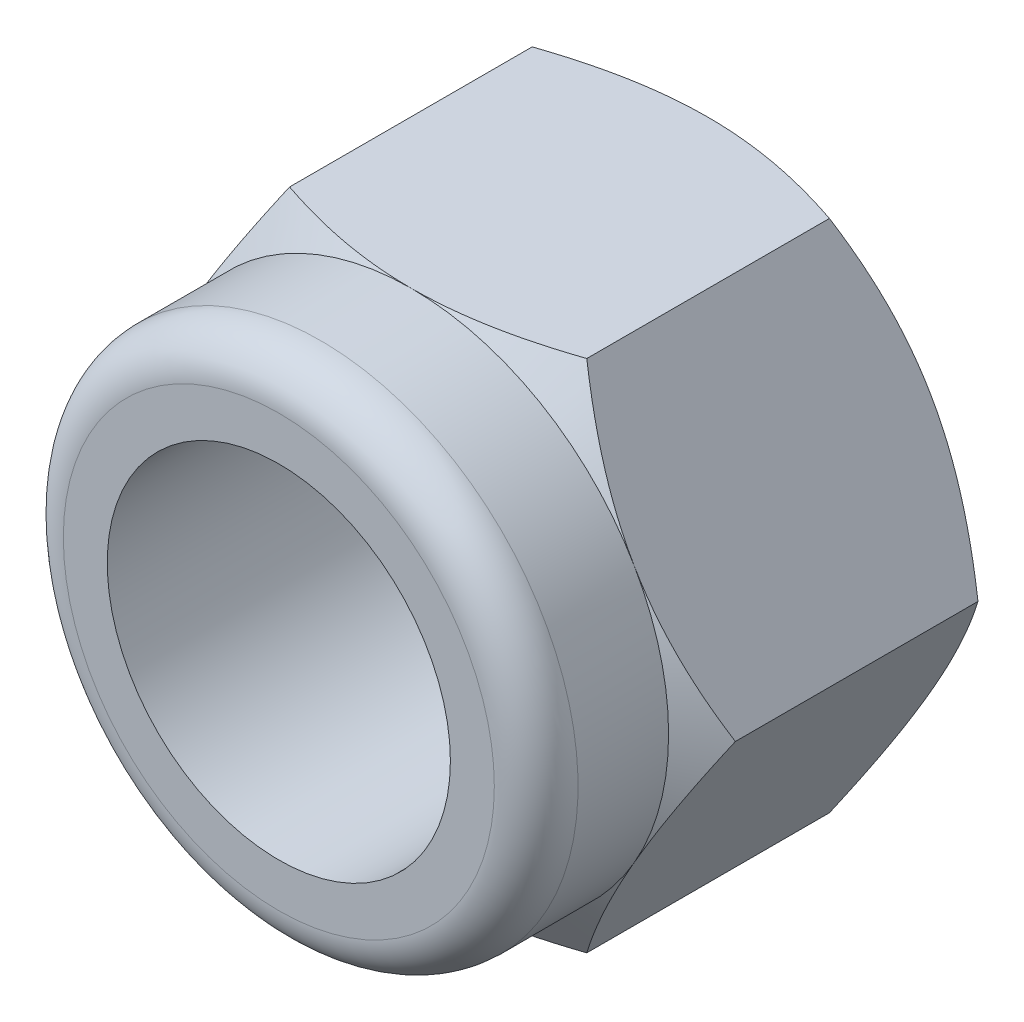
SolidWorks part; units mm, degrees
ref_plane "Plan1" through (0, 0, 0) normal (0, 0, 1) x (1, 0, 0)
ref_plane "Plan2" through (0, 0, 0) normal (0, 1, 0) x (1, 0, 0)
ref_plane "Plan3" through (0, 0, 0) normal (1, 0, 0) x (0, 0, -1)
sketch "Sketch1" plane through (0, 0, 0) normal (0, 0, 1) x (1, 0, 0)
  line L0 (-10.3923, 0) -> (10.3923, 0) construction
  line L1 (0, 9) -> (0, -9) construction
  line L2 (-5.1962, 9) -> (5.1962, 9)
  line L3 (5.1962, 9) -> (10.3923, 0)
  line L4 (10.3923, 0) -> (5.1962, -9)
  line L5 (5.1962, -9) -> (-5.1962, -9)
  line L6 (-5.1962, -9) -> (-10.3923, 0)
  line L7 (-10.3923, 0) -> (-5.1962, 9)
  dimension "D1" = 120
  dimension "S" = 18
extrude "Base-Extrude" add sketch "Sketch1" along normal blind 10.37
sketch "Sketch2" plane through (0, 0, 0) normal (0, 1, 0) x (1, 0, 0)
  line L0 (-10.3923, 0) -> (-10.3923, -0.9427)
  line L1 (-10.3923, -10.37) -> (-10.3923, 0) construction
  line L2 (-10.3923, -0.9427) -> (-9, 0)
  line L4 (-5.1962, 0) -> (-10.3923, 0) construction
  line L5 (0, 0) -> (0, -10.37) construction
  line L6 (5.1962, -10.37) -> (-5.1962, -10.37) construction
  line L7 (5.1962, 0) -> (-5.1962, 0) construction
  line L8 (-9, 0) -> (-10.3923, 0)
  line L9 (-10.3923, -10.37) -> (-10.3923, -9.4273)
  line L10 (-10.3923, -9.4273) -> (-9, -10.37)
  line L11 (-5.1962, -10.37) -> (-10.3923, -10.37) construction
  line L12 (-9, -10.37) -> (-10.3923, -10.37)
  line L13 (0, 0) -> (0, -1.75) construction
  dimension "D1" = 0.9427
  dimension "P" = 1.75
revolve "Cut-Revolve1" cut sketch "Sketch2" angle 360 about L5
sketch "Sketch3" plane through (0, 0, 0) normal (0, 0, -1) x (-1, 0, 0)
  circle A0 centre (0, 0) radius 9
  arc A1 (-7.7942, 4.5) -> (-7.7942, -4.5) centre (0, 0) ccw construction
extrude "Boss-Extrude1" add sketch "Sketch3" against normal blind 15
fillet "Fillet1" radius 1.4641
other "Hole1"
sketch "Sketch4" plane through (0, 0, 0) normal (0, 0, -1) x (-1, 0, 0)
  circle A0 centre (0, 0) radius 5.0528
  arc A1 (-7.7942, 4.5) -> (-7.7942, -4.5) centre (0, 0) ccw construction
  dimension "D1" = 10.1056
chamfer "Chamfer1" distance 0.9472 angle 45
sketch "Esquisse1" plane through (0, 0, 0) normal (0, 0, 1) x (1, 0, 0)
  circle A0 centre (0, 0) radius 6
  dimension "D1" = 12
extrude "DRW" cut sketch "Esquisse1" along normal through all
equation "\"D1@Sketch2\" = \"M@Base-Extrude\" / 11"
equation "\"D1@Fillet1\" = ((\"S@Sketch1\"*1.1547)-\"D@Cosmetic_Thread1\")/6"
equation "\"D1@Sketch4\" = \"D@Cosmetic_Thread1\"-(1.0825*\"P@Sketch2\")"
equation "\"D1@Chamfer1\" = (\"D@Cosmetic_Thread1\"-\"D1@Sketch4\")/2"
